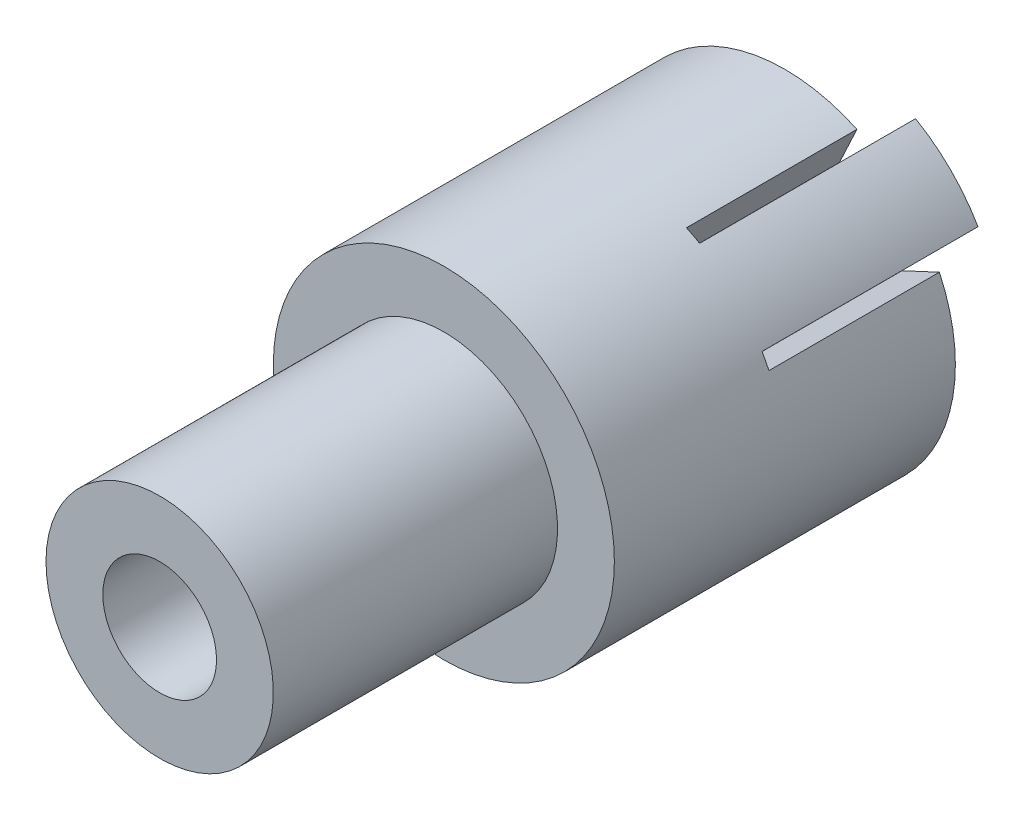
SolidWorks part; units mm, degrees
ref_plane "Front Plane" through (0, 0, 0) normal (0, 0, 1) x (1, 0, 0)
ref_plane "Top Plane" through (0, 0, 0) normal (0, 1, 0) x (1, 0, 0)
ref_plane "Right Plane" through (0, 0, 0) normal (1, 0, 0) x (0, 0, -1)
sketch "Sketch2" plane through (0, 0, 0) normal (1, 0, 0) x (0, 0, -1)
  line L1 (-8.2799, -1.3799) -> (-8.2799, -3.9199)
  line L2 (-8.2799, -3.9199) -> (4.4201, -3.9199)
  line L3 (4.4201, -3.9199) -> (4.4201, -6.4599)
  line L4 (19.6601, -2.7164) -> (17.5803, -0.685)
  line L5 (17.5803, -0.685) -> (15.5961, -2.7164)
  line L6 (15.5961, -2.7164) -> (13.5163, -0.685)
  line L7 (13.5163, -0.685) -> (11.5321, -2.7164)
  line L8 (4.4201, -1.3799) -> (4.4201, 1.1601)
  line L9 (4.4201, 1.1601) -> (6.9601, 1.1601)
  line L11 (4.4201, -1.3799) -> (-8.2799, -1.3799)
  line L12 (4.4201, -6.4599) -> (6.9601, -6.4599)
  line L13 (11.5321, -2.7164) -> (9.4523, -0.685)
  line L14 (9.4523, -0.685) -> (7.4681, -2.7164)
  line L15 (6.9601, -2.7164) -> (7.4681, -2.7164)
  line L16 (19.6601, -2.7164) -> (7.4681, -2.7164) construction
  line L17 (19.6601, -2.7164) -> (19.6601, 1.1601)
  line L18 (19.6601, 1.1601) -> (6.9601, 1.1601)
  line L19 (6.9601, -2.7164) -> (6.9601, -6.4599)
  line L20 (23.4383, -6.4599) -> (-12.2052, -6.4599) construction
  point P6 (6.9601, -2.7164)
  point P8 (6.9601, -2.7164)
  dimension "D1" = 4.064
  dimension "D2" = 2.54
  dimension "D3" = 12.7
  dimension "D4" = 2.54
  dimension "D5" = 1.8451
  dimension "D6" = 2.0314
  dimension "D7" = 2.54
revolve "Revolve1" add sketch "Sketch2" angle 360 about L20
sketch "Sketch3" plane through (0, 0, -19.6601) normal (0, 0, -1) x (-1, 0, 0)
  line L0 (0, -2.7164) -> (0, -0.6844)
  line L1 (0, -10.2034) -> (0, -12.2354)
  line L2 (-3.7435, -6.4599) -> (-5.7755, -6.4599)
  line L3 (3.7435, -6.4599) -> (5.7755, -6.4599)
  circle A0 centre (0, -6.4599) radius 3.7435 construction
  circle A1 centre (0, -6.4599) radius 3.7435 construction
  arc A2 (-5.7755, -6.4599) -> (0, -0.6844) centre (0, -6.4599) cw
  arc A3 (5.7755, -6.4599) -> (0, -12.2354) centre (0, -6.4599) cw
  arc A4 (3.7435, -6.4599) -> (0, -10.2034) centre (0, -6.4599) cw
  arc A5 (-3.7435, -6.4599) -> (0, -2.7164) centre (0, -6.4599) cw
extrude "Cut-Extrude1" cut sketch "Sketch3" against normal blind 12.446
sketch "Sketch4" plane through (0, 0, -19.6601) normal (0, 0, -1) x (-1, 0, 0)
  line L1 (-2.8878, -1.4582) -> (-3.81, 0.1392)
  line L2 (-5.7755, -6.4599) -> (-3.7435, -6.4599) construction
  line L3 (-2.4408, -1.2256) -> (-3.2204, 0.4461)
  line L4 (-5.2344, -4.0191) -> (-6.9061, -3.2396)
  line L5 (-5.0017, -3.5722) -> (-6.5991, -2.6499)
  arc A0 (0, -0.6844) -> (-5.7755, -6.4599) centre (0, -6.4599) ccw construction
  circle A1 centre (0, -6.4599) radius 7.62 construction
  arc A5 (0, -0.6844) -> (-5.7755, -6.4599) centre (0, -6.4599) ccw construction
  arc A6 (-6.5991, -2.6499) -> (-6.9061, -3.2396) centre (0, -6.4599) ccw
  arc A7 (-5.0017, -3.5722) -> (-5.2344, -4.0191) centre (0, -6.4599) ccw
  arc A8 (-3.2204, 0.4461) -> (-3.81, 0.1392) centre (0, -6.4599) ccw
  arc A9 (-2.4408, -1.2256) -> (-2.8878, -1.4582) centre (0, -6.4599) ccw
  dimension "D1" = 5
  dimension "D2" = 30
  dimension "D3" = 25
  dimension "D4" = 5
extrude "Cut-Extrude2" cut sketch "Sketch4" against normal blind 7.62
sketch "Sketch7" plane through (0, 0, -19.6601) normal (0, 0, -1) x (-1, 0, 0)
  line L1 (-5.0017, -3.5722) -> (-6.5991, -2.6499)
  line L2 (-2.8878, -1.4582) -> (-3.81, 0.1392)
  arc A0 (-3.81, 0.1392) -> (-6.5991, -2.6499) centre (0, -6.4599) ccw
  arc A1 (-5.0017, -3.5722) -> (-2.8878, -1.4582) centre (0, -6.4599) cw
extrude "Boss-Extrude1" add sketch "Sketch7" along normal blind 2.032
sketch "Sketch8" plane through (2.7972, -4.845, 0) normal (0.5, -0.866, 0) x (0.866, 0.5, 0)
  line L0 (3.0535, -21.6921) -> (2.5455, -20.5986)
  line L1 (4.39, -21.6921) -> (2.5455, -21.6921) construction
  line L2 (2.5455, -12.0401) -> (2.5455, -21.6921) construction
  line L3 (3.0535, -21.6921) -> (2.5455, -21.6921)
  line L4 (2.5455, -21.6921) -> (2.5455, -20.5986)
  line L5 (-3.2965, -21.6921) -> (-3.2965, -18.6309) construction
  dimension "D1" = 0.508
  dimension "D2" = 5.842
revolve "Cut-Revolve2" cut sketch "Sketch8" angle 360 about L5
